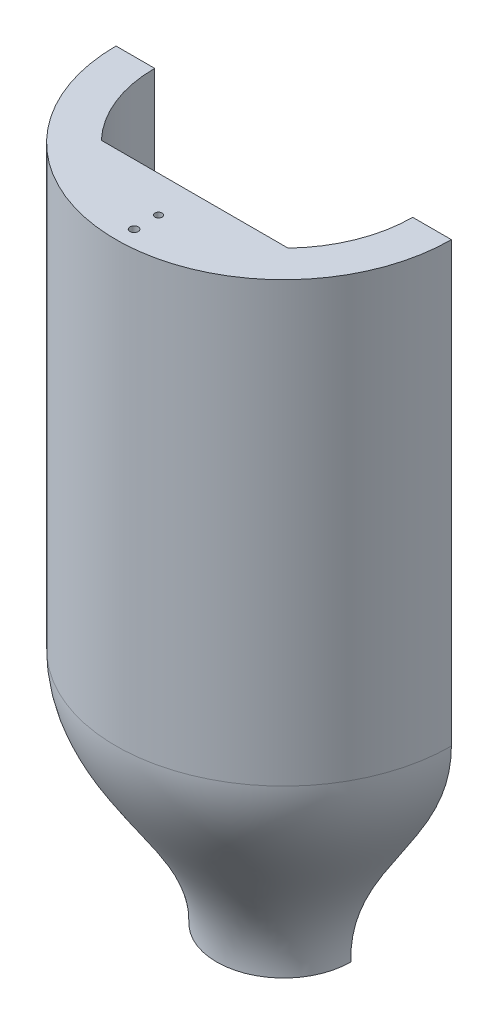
SolidWorks part; units mm, degrees
ref_plane "Front Plane" through (0, 0, 0) normal (0, 0, 1) x (1, 0, 0)
ref_plane "Top Plane" through (0, 0, 0) normal (0, 1, 0) x (1, 0, 0)
ref_plane "Right Plane" through (0, 0, 0) normal (1, 0, 0) x (0, 0, -1)
sketch "Sketch1" plane through (0, 0, 0) normal (0, 1, 0) x (1, 0, 0)
  line L0 (-32.5, 0) -> (32.5, 0)
  arc A0 (-32.5, 0) -> (32.5, 0) centre (0, 0) ccw
  dimension "D1" = 32.5
extrude "Boss-Extrude1" add sketch "Sketch1" along normal blind 85
sketch "Sketch3" plane through (0, 0, 0) normal (0, -1, 0) x (1, 0, 0)
  line L0 (18.0952, 17.25) -> (-18.0952, 17.25)
  line L1 (25, 0) -> (-25, 0)
  arc A0 (-18.0952, 17.25) -> (-25, 0) centre (0, 0) ccw
  arc A2 (25, 0) -> (18.0952, 17.25) centre (0, 0) ccw
  dimension "D1" = 50
  dimension "D2" = 17.25
extrude "Cut-Extrude1" cut sketch "Sketch3" against normal blind 160
sketch "Sketch4" plane through (0, 0, 17.25) normal (0, 0, -1) x (-1, 0, 0)
  line L0 (-0.0048, 60) -> (-0.0048, 0) construction
  line L1 (-3.0048, 60) -> (2.9952, 60)
  line L2 (-3.0048, 60) -> (-3.0048, 0)
  line L3 (-3.0048, 0) -> (2.9952, 0)
  line L4 (2.9952, 60) -> (2.9952, 0)
  line L5 (18.0952, 85) -> (18.0952, 0) construction
  line L6 (18.0952, 85) -> (-18.0952, 85) construction
  line L7 (-18.0952, 0) -> (18.0952, 0) construction
  line L8 (-13.0048, 0) -> (12.9952, 0)
  line L9 (-13.0048, 0) -> (-13.0048, -46)
  line L10 (-13.0048, -46) -> (12.9952, -46)
  line L11 (12.9952, 0) -> (12.9952, -46)
  line L12 (-0.0048, 0) -> (-0.0048, -46)
  point P18 (-0.0048, 52.5)
  point P19 (-0.0048, 37.5)
  point P20 (-0.0048, 22.5)
  point P21 (-0.0048, 7.5)
  dimension "D1" = 6
  dimension "D2" = 60
  dimension "D3" = 18.1
  dimension "D4" = 25
  dimension "D5" = 7.5
  dimension "D6" = 26
  dimension "D7" = 18.1
  dimension "D8" = 15
  dimension "D9" = 15
  dimension "D10" = 15
sketch "Sketch5" plane through (0, 0, 0) normal (0, 0, -1) x (-1, 0, 0)
  line L0 (-32.5, 0) -> (-0.0048, 0)
  line L1 (-3.0048, 0) -> (2.9952, 0) construction
  line L2 (-0.0048, 0) -> (-0.0048, -46)
  line L3 (-0.0048, -46) -> (-13.0048, -46)
  line L4 (-13.0048, 0) -> (-13.0048, -46) construction
  spline S0 degree 3 poles (-32.5, 0) (-32.4106, -17.2686) (-12.6236, -29.1385) (-13.0048, -46) knots 0 0 0 0 1 1 1 1
  dimension "D1" = 46
  dimension "D2" = 13
revolve "Revolve1" add sketch "Sketch5" angle 180 about L2
sketch "Sketch6" plane through (0, 0, 0) normal (0, 0, -1) x (-1, 0, 0)
  line L0 (0, 0) -> (-0.0048, -46)
  line L1 (-13.0048, -46) -> (12.9952, -46) construction
  line L2 (-0.0048, -46) -> (-8.3066, -46)
  line L3 (0, 0) -> (-25, 0)
  spline S0 degree 3 poles (-25, 0) (-25.2587, -16.6334) (-9.4611, -29.3804) (-8.3066, -46) knots 0 0 0 0 1 1 1 1
revolve "Cut-Revolve3" cut sketch "Sketch6" angle 180 about L0
sketch "Sketch7" plane through (0, 0, 0) normal (0, 1, 0) x (1, 0, 0)
  line L0 (25, 0) -> (-25, 0)
  line L1 (0, 0) -> (-25, 0) construction
  line L2 (18.0952, -17.25) -> (-18.0952, -17.25)
  arc A0 (18.0952, -17.25) -> (25, 0) centre (0, 0) ccw
  arc A1 (-25, 0) -> (-18.0952, -17.25) centre (0, 0) ccw
extrude "Cut-Extrude3" cut sketch "Sketch7" against normal blind 0.1
hole_wizard "M2x0.4 Tapped Hole1" positions "Sketch8" profile "Sketch10" tap size "M2x0.4" standard "ANSI Metric"
sketch "Sketch8" plane through (0, 0, 17.25) normal (0, 0, -1) x (-1, 0, 0)
  point P0 (-0.0048, 7.5)
  point P3 (-0.0048, 22.5)
  point P6 (-0.0048, 37.5)
  point P9 (-0.0048, 52.5)
sketch "Sketch10" plane through (0.0048, 7.5, 17.25) normal (1, 0, 0) x (0, 1, 0)
  line L0 (0, 0) -> (0, 4.6807)
  line L1 (0, 4.6807) -> (0.8, 4.2)
  line L2 (0.8, 4.2) -> (0.8, 0)
  line L5 (0.8, 0) -> (0, 0)
  line L10 (0, 4.6807) -> (-0.8, 4.2) construction
  line L11 (0, -6.35) -> (0, 107.95) construction
  dimension "Tap Drill Dia." = 1.6
  dimension "Tap Drill Depth" = 4.2
  dimension "Drill Angle" = 118
sketch "Sketch11" plane through (0, 85, 0) normal (0, 1, 0) x (1, 0, 0)
  line L0 (-18.0952, -17.25) -> (18.0952, -17.25) construction
  circle A0 centre (0, -24.25) radius 0.7
  dimension "D1" = 1.4
  dimension "D2" = 7
extrude "Cut-Extrude4" cut sketch "Sketch11" against normal up to surface (85.0026 mm away)
sketch "Sketch12" plane through (0, -46, 0) normal (0, -1, 0) x (1, 0, 0)
  line L0 (8.3066, 0) -> (13.0048, 0) construction
  point P0 (0, 10.5)
  dimension "D1" = 10.5
hole_wizard "M2x0.4 Tapped Hole2" positions "Sketch13" profile "Sketch14" tap size "M2x0.4" standard "ANSI Metric"
sketch "Sketch13" plane through (0, -46, 0) normal (0, -1, 0) x (-1, 0, 0)
  point P0 (0, -10.5)
sketch "Sketch14" plane through (0, -46, 10.5) normal (1, 0, 0) x (0, 0, -1)
  line L0 (0, 0) -> (0, 4.4807)
  line L1 (0, 4.4807) -> (0.8, 4)
  line L2 (0.8, 4) -> (0.8, 0)
  line L5 (0.8, 0) -> (0, 0)
  line L10 (0, 4.4807) -> (-0.8, 4) construction
  line L11 (0, -6.35) -> (0, 107.95) construction
  dimension "Tap Drill Dia." = 1.6
  dimension "Tap Drill Depth" = 4
  dimension "Drill Angle" = 118
sketch "Sketch15" plane through (0, 0, 0) normal (0, 0, -1) x (-1, 0, 0)
  line L0 (12.9952, -46) -> (8.2972, -46) construction
  line L1 (-8.3066, -46) -> (-13.0048, -46) construction
  point P0 (23.7972, -16)
  point P1 (-23.8066, -16)
  point P8 (28.7972, 19)
  point P9 (-28.8066, 19)
  dimension "D1" = 30
  dimension "D2" = 30
  dimension "D3" = 15.5
  dimension "D4" = 15.5
  dimension "D5" = 20.5
  dimension "D6" = 20.5
  dimension "D7" = 65
  dimension "D8" = 65
hole_wizard "M2x0.4 Tapped Hole3" positions "Sketch16" profile "Sketch17" tap size "M2x0.4" standard "ANSI Metric"
sketch "Sketch16" plane through (0, 0, 0) normal (0, 0, -1) x (-1, 0, 0)
  line L1 (-32.5, 85) -> (-25, 85) construction
  line L2 (25, 85) -> (32.5, 85) construction
  line L3 (-32.5, 85) -> (-32.5, 0) construction
  point P0 (-23.8066, -16)
  point P3 (23.7972, -16)
  point P6 (-28.8066, 19)
  point P9 (28.7972, 19)
  point P12 (28.7972, 67)
  point P14 (-28.8, 67)
  dimension "D1" = 18
  dimension "D2" = 18
  dimension "D3" = 3.7
sketch "Sketch17" plane through (23.8066, -16, 0) normal (1, 0, 0) x (0, 1, 0)
  line L0 (0, 0) -> (0, 3.4807)
  line L1 (0, 3.4807) -> (0.8, 3)
  line L2 (0.8, 3) -> (0.8, 0)
  line L5 (0.8, 0) -> (0, 0)
  line L10 (0, 3.4807) -> (-0.8, 3) construction
  line L11 (0, -6.35) -> (0, 107.95) construction
  dimension "Tap Drill Dia." = 1.6
  dimension "Tap Drill Depth" = 3
  dimension "Drill Angle" = 118
sketch "Sketch18" plane through (0, 85, 0) normal (0, 1, 0) x (1, 0, 0)
  line L0 (32.5, 0) -> (25, 0) construction
  point P0 (0, -29)
  dimension "D1" = 29
hole_wizard "M2x0.4 Tapped Hole4" positions "Sketch19" profile "Sketch20" tap size "M2x0.4" standard "ANSI Metric"
sketch "Sketch19" plane through (0, 85, 0) normal (0, 1, 0) x (1, 0, 0)
  point P0 (0, -29)
sketch "Sketch20" plane through (0, 85, 29) normal (1, 0, 0) x (0, 0, 1)
  line L0 (0, 0) -> (0, 3.4807)
  line L1 (0, 3.4807) -> (0.8, 3)
  line L2 (0.8, 3) -> (0.8, 0)
  line L5 (0.8, 0) -> (0, 0)
  line L10 (0, 3.4807) -> (-0.8, 3) construction
  line L11 (0, -6.35) -> (0, 107.95) construction
  dimension "Tap Drill Dia." = 1.6
  dimension "Tap Drill Depth" = 3
  dimension "Drill Angle" = 118
